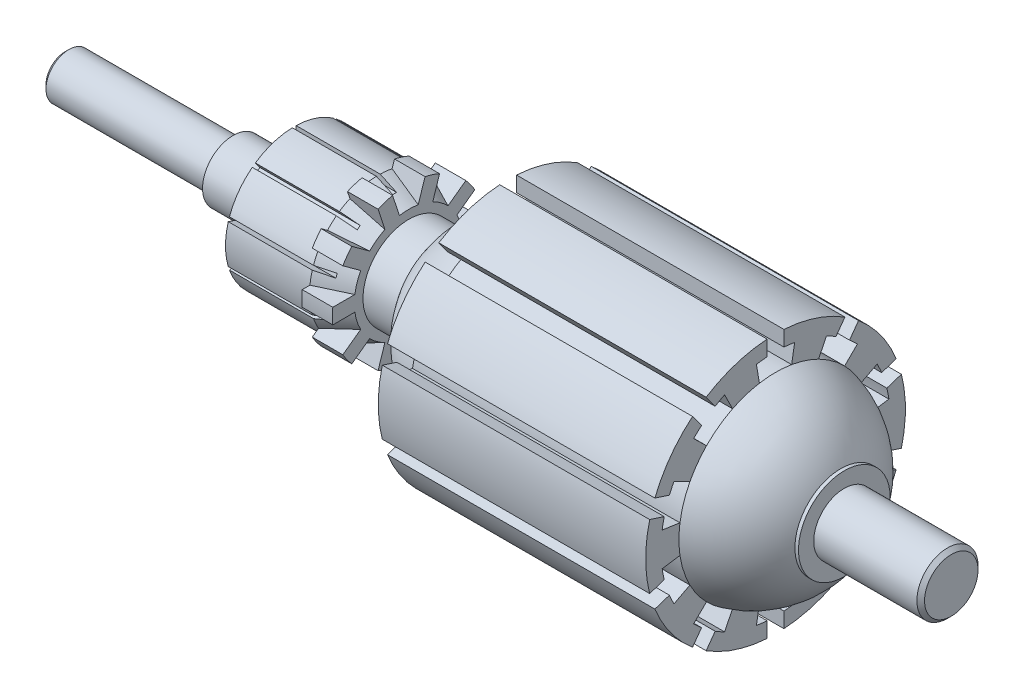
SolidWorks part; units mm, degrees
ref_plane "Plan1" through (0, 0, 0) normal (0, 0, 1) x (1, 0, 0)
ref_plane "Plan2" through (0, 0, 0) normal (0, 1, 0) x (1, 0, 0)
ref_plane "Plan3" through (0, 0, 0) normal (1, 0, 0) x (0, 0, -1)
sketch "Esquisse1" plane through (0, 0, 0) normal (0, 0, 1) x (1, 0, 0)
  line L0 (141, 0) -> (-110, 0) construction
  line L1 (0, 2.99) -> (22, 2.99)
  line L2 (22, 2.99) -> (22, 4)
  line L3 (22, 4) -> (30, 4)
  line L4 (30, 4) -> (30, 9)
  line L5 (30, 9) -> (41, 9)
  line L6 (41, 9) -> (41, 10)
  line L7 (41, 10) -> (45, 10)
  line L8 (45, 10) -> (45, 6)
  line L9 (45, 6) -> (49.4674, 6)
  line L10 (58, 12.6491) -> (58, 17)
  line L11 (58, 17) -> (93, 17)
  line L12 (116, 0) -> (116, 4)
  line L13 (116, 4) -> (102, 4)
  line L14 (102, 4) -> (102, 6)
  line L15 (102, 6) -> (101.5326, 6)
  line L16 (93, 17) -> (93, 12.6491)
  line L17 (0, 2.99) -> (0, 0)
  line L18 (0, 0) -> (116, 0)
  arc A0 (58, 12.6491) -> (49.4674, 6) centre (61, 0) ccw
  arc A1 (101.5326, 6) -> (93, 12.6491) centre (90, 0) ccw
  point P23 (0, 0)
  dimension "D14" = 116
  dimension "D15" = 26
  dimension "D20" = 4.4674
  dimension "D1" = 22
  dimension "D2" = 2.99
  dimension "D3" = 8
  dimension "D4" = 4
  dimension "D5" = 9
  dimension "D6" = 10
  dimension "D7" = 6
  dimension "D8" = 45
  dimension "D9" = 4
  dimension "D10" = 26
  dimension "D11" = 13
  dimension "D12" = 35
  dimension "D13" = 17
  dimension "D16" = 4
  dimension "D17" = 14
  dimension "D18" = 6
  dimension "D19" = 29
revolve "Base-Révolution" add sketch "Esquisse1" angle 360 about L0
chamfer "Chanfrein1" distance 0.5 angle 45
sketch "Esquisse2" plane through (58, 0, 0) normal (-1, 0, 0) x (0, 0, 1)
  line L0 (0, 0) -> (0, 18.6502) construction
  line L1 (1.1, 16.9644) -> (1.1, 14.9596)
  line L2 (-1.1, 16.9644) -> (-1.1, 14.9596)
  line L4 (2.5, 14.7902) -> (2.1082, 12.4722)
  line L5 (-2.5, 14.7902) -> (-2.1082, 12.4722)
  arc A0 (2.5, 14.7902) -> (1.1, 14.9596) centre (0, 0) ccw
  arc A1 (-1.1, 14.9596) -> (-2.5, 14.7902) centre (0, 0) ccw
  circle A2 centre (0, 0) radius 17 construction
  arc A3 (1.1, 16.9644) -> (-1.1, 16.9644) centre (0, 0) ccw
  circle A4 centre (0, 0) radius 12.6491 construction
  arc A5 (2.1082, 12.4722) -> (-2.1082, 12.4722) centre (0, 0) ccw
  dimension "D1" = 30
  dimension "D3" = 5
  dimension "D2" = 1.1
extrude "Enlèv. mat.-Extru.1" cut sketch "Esquisse2" against normal through all
pattern_circular "Répétition circulaire1" count 10 every 36
sketch "Esquisse3" plane through (41, 0, 0) normal (-1, 0, 0) x (0, 0, 1)
  line L0 (0, 0) -> (0, 19.093) construction
  line L1 (0, 0) -> (6.2256, 19.1603) construction
  line L2 (4.4821, 17.0306) -> (-0.891, 0.4938) construction
  line L3 (2.1236, 9.7719) -> (1.1899, 6.8981)
  line L5 (-2.1236, 9.7719) -> (-1.1899, 6.8981)
  arc A1 (1.1899, 6.8981) -> (-1.1899, 6.8981) centre (0, 0) ccw
  circle A2 centre (0, 0) radius 10 construction
  arc A3 (2.1236, 9.7719) -> (-2.1236, 9.7719) centre (0, 0) ccw
  dimension "D3" = 14
  dimension "D1" = 18
  dimension "D2" = 1
extrude "Enlèv. mat.-Extru.2" cut sketch "Esquisse3" against normal blind 4
pattern_circular "Répétition circulaire2" count 10 every 36
sketch "Esquisse4" plane through (41, 0, 0) normal (1, 0, 0) x (0, 0, -1)
  circle A0 centre (0, 0) radius 9
  dimension "D1" = 18
extrude "Boss.-Extru.1" add sketch "Esquisse4" along normal blind 4 draft 25
sketch "Esquisse5" plane through (30, 0, 0) normal (-1, 0, 0) x (0, 0, 1)
  line L0 (0, 0) -> (0, 18.1895) construction
  line L1 (0.25, 8.9965) -> (0.25, 7.9961)
  line L2 (-0.25, 8.9965) -> (-0.25, 7.9961)
  circle A0 centre (0, 0) radius 9 construction
  arc A1 (0.25, 8.9965) -> (-0.25, 8.9965) centre (0, 0) ccw
  arc A2 (0.25, 7.9961) -> (-0.25, 7.9961) centre (0, 0) ccw
  dimension "D2" = 16
  dimension "D1" = 0.25
extrude "Enlèv. mat.-Extru.3" cut sketch "Esquisse5" against normal up to next
pattern_circular "Répétition circulaire3" count 10 every 36 about axis through (141, 0, 0) along (-1, 0, 0)
